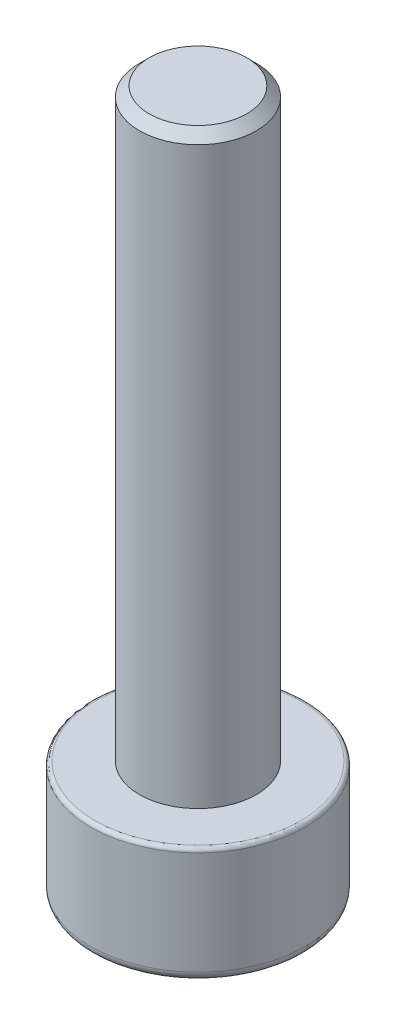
SolidWorks part; units mm, degrees
ref_plane "Front Plane" through (0, 0, 0) normal (0, 0, 1) x (1, 0, 0)
ref_plane "Top Plane" through (0, 0, 0) normal (0, 1, 0) x (1, 0, 0)
ref_plane "Right Plane" through (0, 0, 0) normal (1, 0, 0) x (0, 0, -1)
sketch "Sketch1" plane through (0, 0, 0) normal (0, 1, 0) x (1, 0, 0)
  circle A0 centre (0, 0) radius 2.75
  dimension "D1" = 5.5
extrude "Boss-Extrude1" add sketch "Sketch1" along normal blind 3
sketch "Sketch2" plane through (0, 3, 0) normal (0, 1, 0) x (1, 0, 0)
  circle A0 centre (0, 0) radius 1.5
  dimension "D1" = 3
extrude "Boss-Extrude2" add sketch "Sketch2" along normal blind 15 contours A0
sketch "Sketch3" plane through (0, 0, 0) normal (0, -1, 0) x (1, 0, 0)
  line L1 (0.9342, 0.9746) -> (-0.3769, 1.2963)
  line L2 (-0.3769, 1.2963) -> (-1.3111, 0.3217)
  line L3 (-1.3111, 0.3217) -> (-0.9342, -0.9746)
  line L4 (-0.9342, -0.9746) -> (0.3769, -1.2963)
  line L5 (0.3769, -1.2963) -> (1.3111, -0.3217)
  line L6 (1.3111, -0.3217) -> (0.9342, 0.9746)
  circle A0 centre (0, 0) radius 1.1691 construction
  dimension "D1" = 2.7
extrude "Cut-Extrude1" cut sketch "Sketch3" against normal blind 1.5
chamfer "Chamfer1" distance 0.25 distance2 0.25 6 edges at (-0.2786, 0, -1.1355) (-1.1226, 0, -0.3264) (-0.844, 0, 0.809) (0.2786, 0, 1.1355) (1.1226, 0, 0.3264) (0.844, 0, -0.809)
fillet "Fillet1" radius 0.25 1 edges at (0, 0, 2.75)
chamfer "Chamfer2" distance 0.25 angle 45 1 edges at (0, 18, 1.5)
fillet "Fillet2" radius 0.1 1 edges at (0, 3, 2.75)
